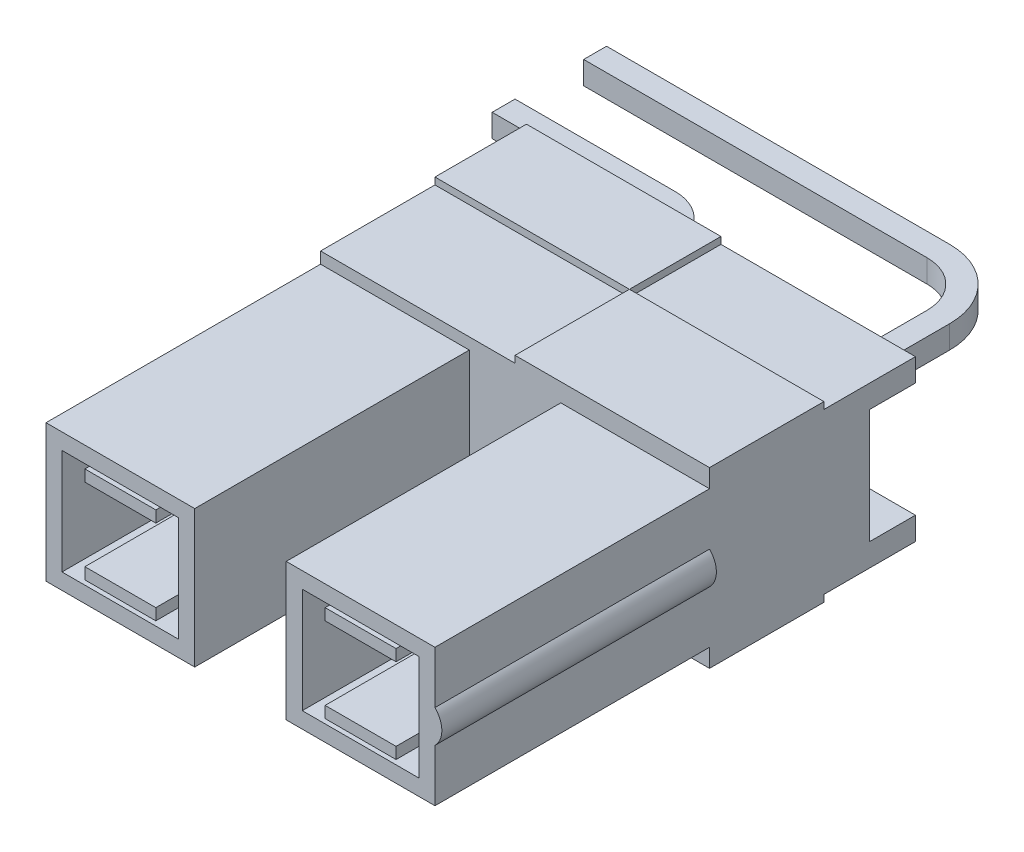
SolidWorks part; units mm, degrees
ref_plane "Plan de face" through (0, 0, 0) normal (0, 0, 1) x (1, 0, 0)
ref_plane "Plan de dessus" through (0, 0, 0) normal (0, 1, 0) x (1, 0, 0)
ref_plane "Plan de droite" through (0, 0, 0) normal (1, 0, 0) x (0, 0, -1)
sketch "Esquisse1" plane through (0, 0, 0) normal (0, 0, 1) x (1, 0, 0)
  line L0 (1.35, -1.15) -> (3.9, -1.15)
  line L1 (-4.25, 1.5) -> (-1, 1.5)
  line L2 (-4.25, 1.5) -> (-4.25, -1.5)
  line L3 (-4.25, -1.5) -> (-1, -1.5)
  line L4 (4.25, 1.5) -> (4.25, -1.5)
  line L5 (3.9, 1.15) -> (3.9, -1.15)
  line L6 (1, 1.5) -> (4.25, 1.5)
  line L7 (1.35, 1.15) -> (3.9, 1.15)
  line L8 (-1, 1.5) -> (-1, -1.5)
  line L9 (1.35, 1.15) -> (1.35, -1.15)
  line L10 (1, 1.5) -> (1, -1.5)
  line L11 (1, -1.5) -> (4.25, -1.5)
  line L12 (-3.9, -1.15) -> (-1.35, -1.15)
  line L13 (-1.35, 1.15) -> (-1.35, -1.15)
  line L14 (-3.9, 1.15) -> (-1.35, 1.15)
  line L15 (-3.9, 1.15) -> (-3.9, -1.15)
  point P4 (0, 0)
  dimension "D1" = 8.5
  dimension "D2" = 3
  dimension "D3" = 2
  dimension "D4" = 1
  dimension "D5" = 4.25
  dimension "D6" = 3
  dimension "D7" = 0.35
  dimension "D8" = 0.35
extrude "Extrusion1" add sketch "Esquisse1" along normal blind 6
sketch "Esquisse2" plane through (0, 0, 0) normal (0, 0, -1) x (-1, 0, 0)
  line L0 (4.25, 1.5) -> (4.25, -1.5) construction
  line L1 (-4.25, -1.75) -> (4.25, -1.75)
  line L2 (-4.25, -1.75) -> (-4.25, 1.75)
  line L3 (-4.25, 1.75) -> (4.25, 1.75)
  line L4 (4.25, -1.75) -> (4.25, 1.75)
  line L5 (-4.25, -1.5) -> (-4.25, 1.5) construction
  dimension "D1" = 1.75
  dimension "D2" = 1.75
extrude "Extrusion2" add sketch "Esquisse2" along normal blind 4.5
sketch "Esquisse3" plane through (4.25, 0, 0) normal (1, 0, 0) x (0, 0, -1)
  line L0 (4.5, 1.75) -> (4.5, -1.75) construction
  line L1 (4.7753, 1.25) -> (3.5, 1.25)
  line L2 (4.7753, 1.25) -> (4.7753, -1.25)
  line L3 (4.7753, -1.25) -> (3.5, -1.25)
  line L4 (3.5, 1.25) -> (3.5, -1.25)
  dimension "D1" = 1
  dimension "D2" = 2.5
  dimension "D3" = 1.25
extrude "Enlèv. mat.-Extru.1" cut sketch "Esquisse3" against normal through all
sketch "Esquisse5" plane through (0, 0, 6) normal (0, 0, 1) x (1, 0, 0)
  line L0 (3.9, -1.15) -> (3.9, 1.15) construction
  line L1 (4.25, -1.5) -> (4.25, 1.5) construction
  line L2 (4.25, -0.3571) -> (4.25, 0.3571)
  arc A0 (4.25, -0.3571) -> (4.25, 0.3571) centre (3.9, 0) ccw
  dimension "D1" = 1
extrude "Extrusion3" add sketch "Esquisse5" against normal up to surface (6 mm away)
sketch "Esquisse6" plane through (-4.25, 0, 0) normal (-1, 0, 0) x (0, 0, 1)
  line L1 (-0.2, 0.25) -> (0.2, 0.25)
  line L3 (-0.2, -0.25) -> (0.2, -0.25)
  arc A0 (-0.2, 0.25) -> (-0.2, -0.25) centre (-0.2, 0) ccw
  arc A1 (0.2, -0.25) -> (0.2, 0.25) centre (0.2, 0) ccw
  dimension "D1" = 0.25
  dimension "D2" = 0.25
  dimension "D3" = 0.2
  dimension "D4" = 0.2
extrude "Extrusion4" add sketch "Esquisse6" along normal blind 0.5
sketch "Esquisse7" plane through (0, 1.75, 0) normal (0, 1, 0) x (-1, 0, 0)
  line L0 (4.25, 0) -> (-4.25, 0) construction
  line L1 (4.25, -4.5) -> (0, -4.5)
  line L2 (4.25, -4.5) -> (4.25, -2.5)
  line L3 (4.25, -2.5) -> (0.0101, -2.5)
  line L4 (0, -4.5) -> (0, -2.5101)
  line L5 (-4.25, 0) -> (0, 0)
  line L6 (-4.25, 0) -> (-4.25, -2.5)
  line L7 (-4.25, -2.5) -> (-0.0101, -2.5)
  line L8 (0, 0) -> (0, -2.4899)
  arc A0 (-0.0101, -2.5) -> (0, -2.5101) centre (0, -2.5) ccw
  arc A1 (0.0101, -2.5) -> (0, -2.4899) centre (0, -2.5) ccw
  dimension "D1" = 2
extrude "Extrusion5" add sketch "Esquisse7" along normal blind 0.15
mirror "Symétrie1" about plane through (0, 0, 0) normal (0, 1, 0) of "Extrusion5"
sketch "Esquisse9" plane through (0, 0, 0) normal (0, 0, 1) x (1, 0, 0)
  line L0 (-3.9, 1.15) -> (-3.9, -1.15) construction
  line L1 (-3.4, 1.05) -> (-1.85, 1.05)
  line L2 (-3.4, 1.05) -> (-3.4, 0.8)
  line L3 (-3.4, 0.8) -> (-1.85, 0.8)
  line L4 (-1.85, 1.05) -> (-1.85, 0.8)
  line L5 (-1.35, 1.15) -> (-3.9, 1.15) construction
  line L6 (-1.35, -1.15) -> (-1.35, 1.15) construction
  line L7 (0, -1.403) -> (0, 1.2548) construction
  line L8 (3.4, 1.05) -> (3.4, 0.8)
  line L9 (3.4, 0.8) -> (1.85, 0.8)
  line L10 (1.85, 1.05) -> (1.85, 0.8)
  line L11 (3.4, 1.05) -> (1.85, 1.05)
  line L12 (-3.6106, 0) -> (3.6669, 0) construction
  line L13 (1.85, -1.05) -> (1.85, -0.8)
  line L14 (3.4, -1.05) -> (1.85, -1.05)
  line L15 (3.4, -1.05) -> (3.4, -0.8)
  line L16 (3.4, -0.8) -> (1.85, -0.8)
  line L17 (-1.85, -1.05) -> (-1.85, -0.8)
  line L18 (-3.4, -1.05) -> (-3.4, -0.8)
  line L19 (-3.4, -1.05) -> (-1.85, -1.05)
  line L20 (-3.4, -0.8) -> (-1.85, -0.8)
  point P4 (-3.9, 0)
  point P10 (-1.85, 0.925)
  point P29 (-1.85, -0.925)
  dimension "D1" = 0.5
  dimension "D2" = 0.5
  dimension "D3" = 0.25
  dimension "D4" = 0.1
extrude "Extrusion9" add sketch "Esquisse9" along normal up to surface (6 mm away)
sketch "Esquisse10" plane through (0, 0, -3.5) normal (0, 0, -1) x (-1, 0, 0)
  line L0 (-2.5, 0) -> (-0.5916, 0) construction
  line L1 (-2.5, -0.25) -> (-2, -0.25)
  line L2 (-2.5, -0.25) -> (-2.5, 0.25)
  line L3 (-2.5, 0.25) -> (-2, 0.25)
  line L4 (-2, -0.25) -> (-2, 0.25)
  line L5 (0, -0.8976) -> (0, 1.0346) construction
  line L6 (2.5, -0.25) -> (2, -0.25)
  line L7 (2.5, -0.25) -> (2.5, 0.25)
  line L8 (2.5, 0.25) -> (2, 0.25)
  line L9 (2, -0.25) -> (2, 0.25)
  dimension "D1" = 0.5
  dimension "D2" = 0.5
  dimension "D3" = 2
extrude "Extrusion10" add sketch "Esquisse10" along normal blind 5
sketch "Esquisse11" plane through (0, 0, -8.5) normal (0, 0, -1) x (-1, 0, 0)
  line L4 (2.5, -0.25) -> (2.5, 0.25)
  line L5 (2.5, 0.25) -> (2, 0.25)
  line L6 (2, 0.25) -> (2, -0.25)
  line L7 (2, -0.25) -> (2.5, -0.25)
  line L8 (2.5, -0.25) -> (2.5, 0.25)
  line L9 (2.5, 0.25) -> (2, 0.25)
  line L10 (2, 0.25) -> (2, -0.25)
  line L11 (2, -0.25) -> (2.5, -0.25)
  dimension "D1" = 0
extrude "Enlèv. mat.-Extru.2" cut sketch "Esquisse11" against normal blind 2
sketch "Esquisse12" plane through (-2.5, 0, 0) normal (-1, 0, 0) x (0, 0, 1)
  line L0 (-6.5, 0.25) -> (-3.5, 0.25) construction
  line L1 (-6.5, -0.25) -> (-6, -0.25)
  line L2 (-6.5, -0.25) -> (-6.5, 0.25)
  line L3 (-6.5, 0.25) -> (-6, 0.25)
  line L4 (-6, -0.25) -> (-6, 0.25)
  dimension "D1" = 0.5
extrude "Extrusion11" add sketch "Esquisse12" along normal blind 4
fillet "Congé1" radius 0.5 1 edges at (-2.5, 0, -6)
fillet "Congé2" radius 1 1 edges at (-2, 0, -6.5)
sketch "Esquisse13" plane through (2, 0, 0) normal (-1, 0, 0) x (0, 0, 1)
  line L0 (-8.5, 0.25) -> (-3.5, 0.25) construction
  line L1 (-8.5, -0.25) -> (-8, -0.25)
  line L2 (-8.5, -0.25) -> (-8.5, 0.25)
  line L3 (-8.5, 0.25) -> (-8, 0.25)
  line L4 (-8, -0.25) -> (-8, 0.25)
  dimension "D1" = 0.5
extrude "Extrusion12" add sketch "Esquisse13" along normal up to surface (8.5 mm away)
fillet "Congé3" radius 1.5 1 edges at (2.5, 0, -8.5)
fillet "Congé4" radius 1 1 edges at (2, 0, -8)
